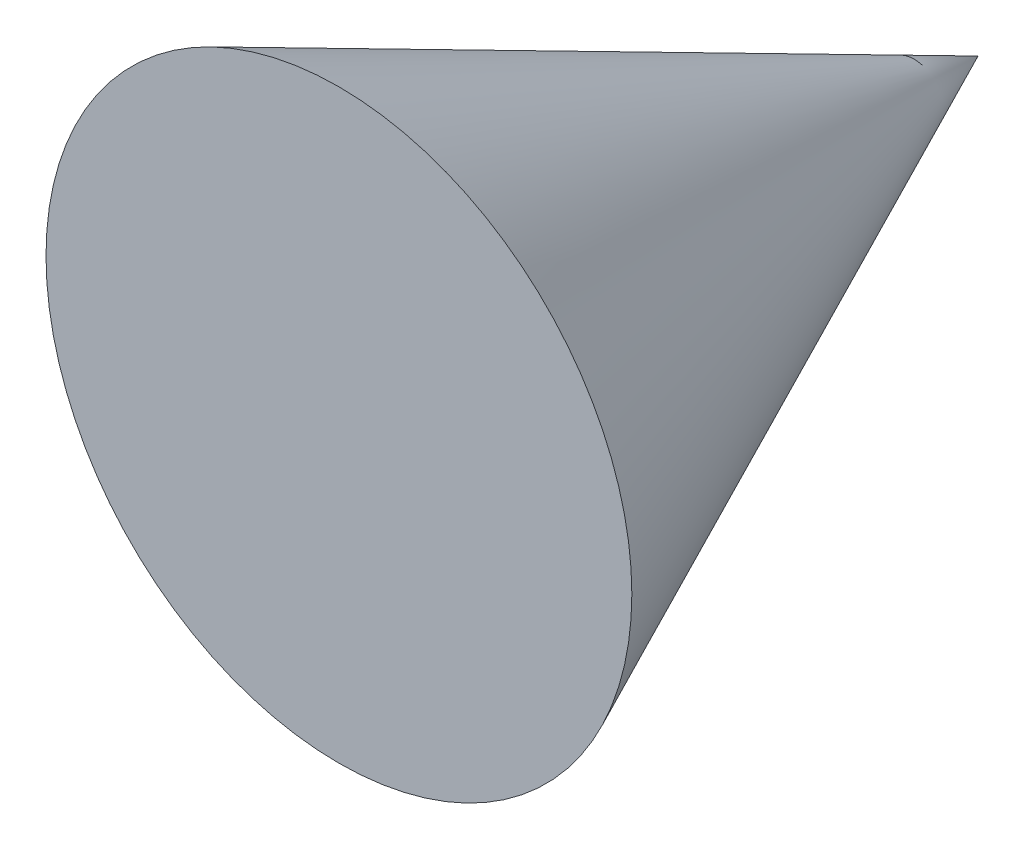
SolidWorks part; units mm, degrees
ref_plane "前视基准面" through (0, 0, 0) normal (0, 0, 1) x (1, 0, 0)
ref_plane "上视基准面" through (0, 0, 0) normal (0, 1, 0) x (1, 0, 0)
ref_plane "右视基准面" through (0, 0, 0) normal (1, 0, 0) x (0, 0, -1)
sketch "草图1" plane through (0, 0, 0) normal (0, 1, 0) x (1, 0, 0)
  line L0 (0, 52.6676) -> (0, -65.7412) construction
  line L1 (0, 35.1576) -> (-25, -19.3859)
  line L2 (-25, -19.3859) -> (0, -19.3859)
  line L3 (0, 35.1576) -> (0, -19.3859)
  dimension "D1" = 60
  dimension "D2" = 25
revolve "旋转1" add sketch "草图1" angle 360 about L0
